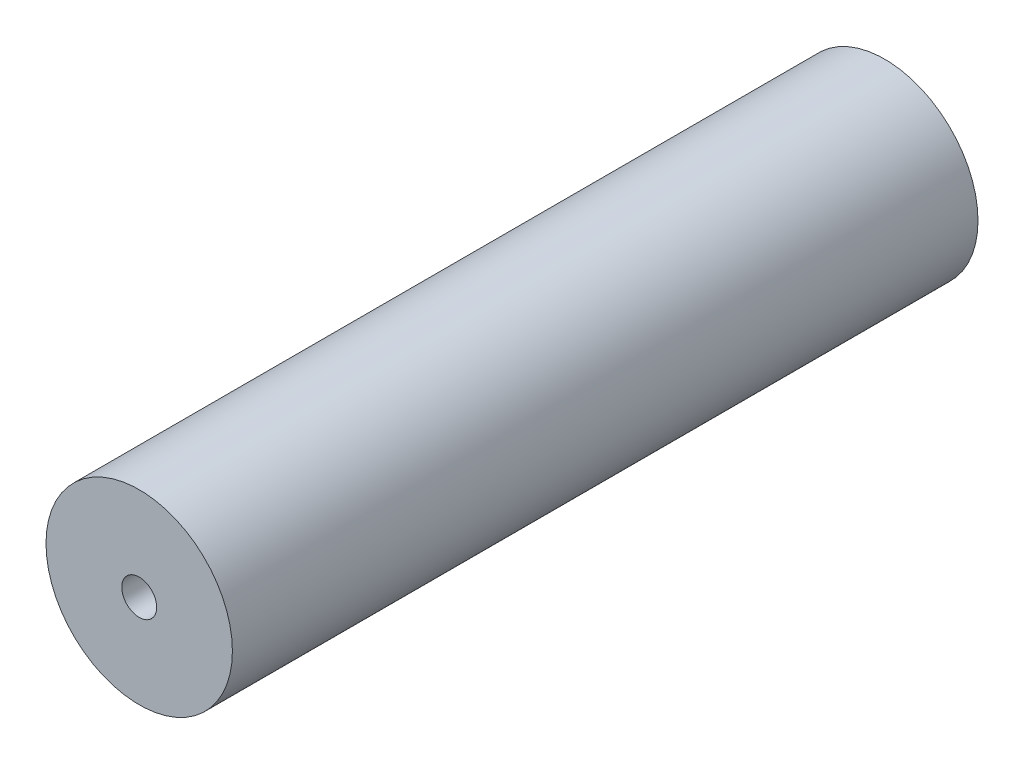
SolidWorks part; units mm, degrees
ref_plane "Front" through (0, 0, 0) normal (0, 0, 1) x (1, 0, 0)
ref_plane "Top" through (0, 0, 0) normal (0, 1, 0) x (1, 0, 0)
ref_plane "Right" through (0, 0, 0) normal (1, 0, 0) x (0, 0, -1)
sketch "Sketch1" plane through (0, 0, 0) normal (0, 0, 1) x (1, 0, 0)
  circle A0 centre (0, 0) radius 50.8
  circle A1 centre (0, 0) radius 9.525
  dimension "D1" = 101.6
  dimension "D2" = 19.05
extrude "Extrude1" add sketch "Sketch1" along normal mid plane 406.4
